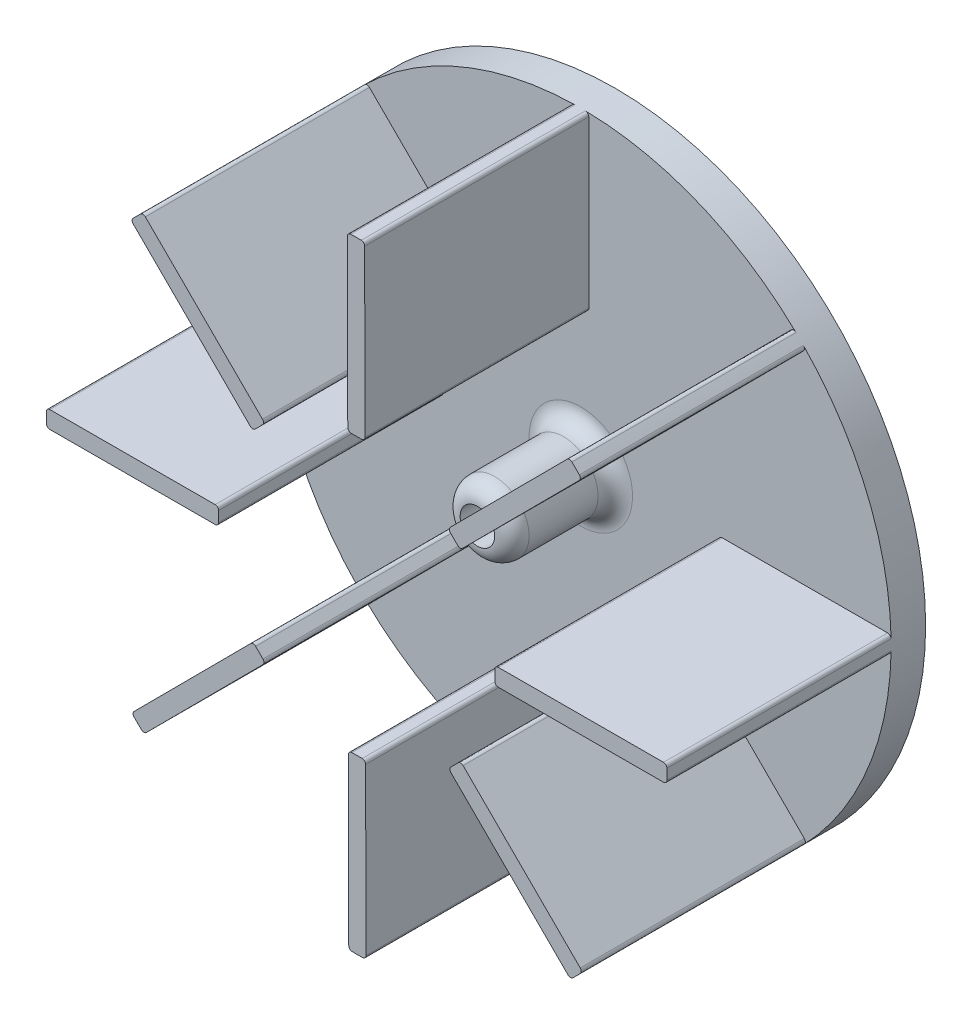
SolidWorks part; units mm, degrees
ref_plane "Front Plane" through (0, 0, 0) normal (0, 0, 1) x (1, 0, 0)
ref_plane "Top Plane" through (0, 0, 0) normal (0, 1, 0) x (1, 0, 0)
ref_plane "Right Plane" through (0, 0, 0) normal (1, 0, 0) x (0, 0, -1)
sketch "Sketch2" plane through (0, 0, 0) normal (0, 0, 1) x (1, 0, 0)
  circle A0 centre (0, 0) radius 18
  circle A1 centre (0, 0) radius 1
  dimension "D1" = 36
  dimension "D2" = 2
extrude "Boss-Extrude1" add sketch "Sketch2" against normal blind 2
sketch "Sketch5" plane through (0, 0, 0) normal (0, 0, 1) x (1, 0, 0)
  circle A0 centre (0, 0) radius 1
  circle A1 centre (0, 0) radius 2
  dimension "D1" = 4
  dimension "D2" = 2
extrude "Boss-Extrude3" add sketch "Sketch5" along normal blind 6
fillet "Fillet6" radius 1 2 edges at (2, 0, 6) (2, 0, 0)
sketch "Sketch6" plane through (0, 0, 0) normal (0, 0, 1) x (1, 0, 0)
  line L0 (0, 0) -> (11.6116, 11.6627) construction
  line L1 (6.0048, 5.3225) -> (13.0494, 12.3981)
  line L2 (5.2961, 6.0281) -> (12.3407, 13.1037)
  line L3 (5.2961, 6.0281) -> (6.0048, 5.3225)
  circle A0 centre (0, 0) radius 8.0241 construction
  circle A2 centre (0, 0) radius 18 construction
  arc A3 (13.0494, 12.3981) -> (12.3407, 13.1037) centre (0, 0) ccw
  dimension "D1" = 0.5
  dimension "D2" = 0.5
extrude "Boss-Extrude4" add sketch "Sketch6" along normal blind 13
fillet "Fillet7" radius 0.2 4 edges at (5.2961, 6.0281, 6.5) (6.0048, 5.3225, 6.5) (13.0494, 12.3981, 6.5) (12.3407, 13.1037, 6.5)
pattern_circular "CirPattern2" count 8 over 360 about axis through (0, 0, 0) along (0, 0, 1) of "Boss-Extrude4", "Fillet7"
